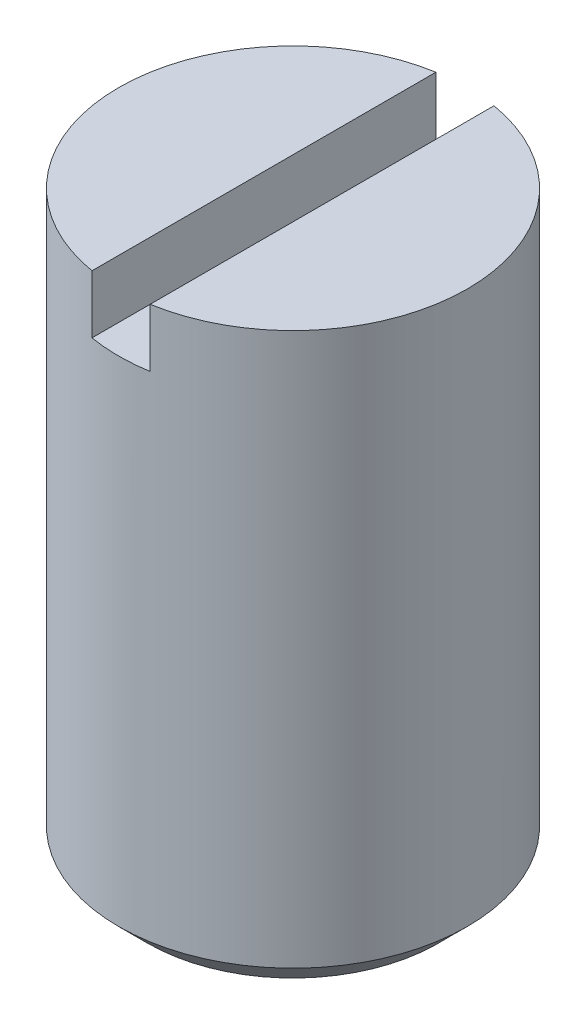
SolidWorks part; units mm, degrees
ref_plane "Front" through (0, 0, 0) normal (0, 0, 1) x (1, 0, 0)
ref_plane "Top" through (0, 0, 0) normal (0, 1, 0) x (1, 0, 0)
ref_plane "Right" through (0, 0, 0) normal (1, 0, 0) x (0, 0, -1)
sketch "Sketch1" plane through (0, 0, 0) normal (0, 1, 0) x (1, 0, 0)
  circle A0 centre (0, 0) radius 3
extrude "Extrude1" add sketch "Sketch1" along normal blind 10
chamfer "Chamfer1" distance 0.5 angle 45 1 edges at (0, 0, 3)
sketch "Sketch2" plane through (0, 10, 0) normal (0, 1, 0) x (-1, 0, 0)
  line L0 (0, -3) -> (0, 3) construction
  line L1 (0.5, -3) -> (0.5, 3)
  line L2 (-0.5, -3) -> (-0.5, 3)
  line L3 (-0.5, 3) -> (0.5, 3)
  line L4 (0.5, -3) -> (-0.5, -3)
  circle A0 centre (0, 0) radius 3 construction
extrude "Cut-Extrude1" cut sketch "Sketch2" against normal blind 1
